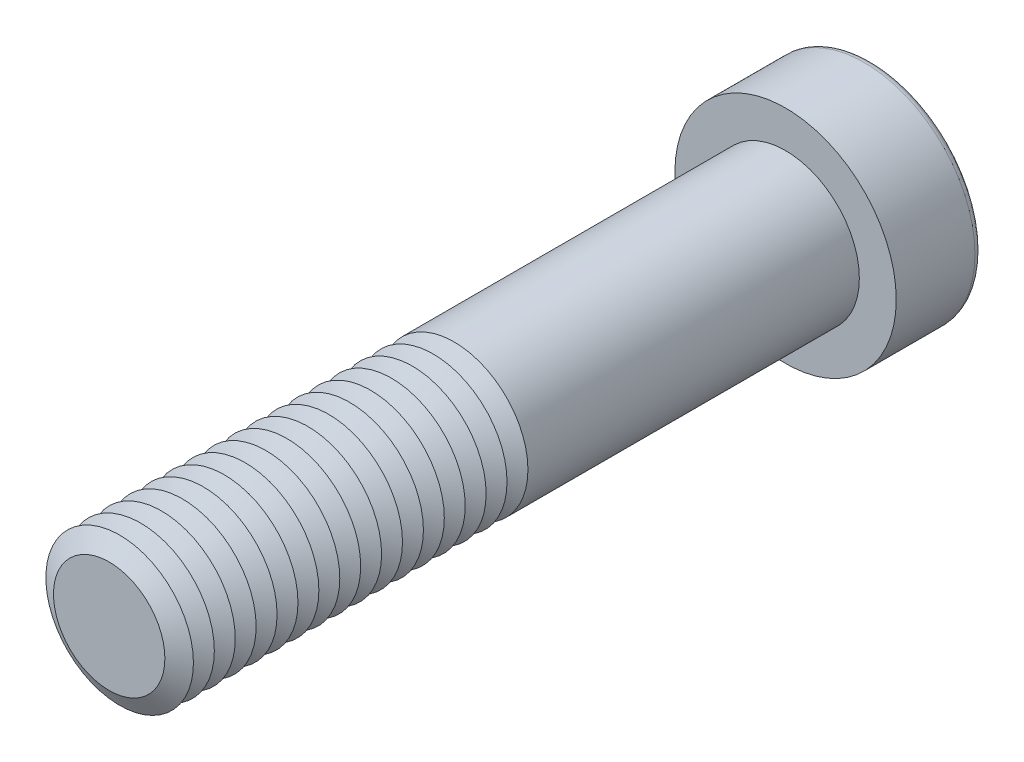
SolidWorks part; units mm, degrees
ref_plane "Front Plane" through (0, 0, 0) normal (0, 0, 1) x (1, 0, 0)
ref_plane "Top Plane" through (0, 0, 0) normal (0, 1, 0) x (1, 0, 0)
ref_plane "Right Plane" through (0, 0, 0) normal (1, 0, 0) x (0, 0, -1)
sketch "Sketch1" plane through (0, 0, 0) normal (0, 0, 1) x (1, 0, 0)
  circle A0 centre (0, 0) radius 6
  dimension "D1" = 12
extrude "Boss-Extrude1" add sketch "Sketch1" along normal blind 55
sketch "Sketch2" plane through (0, 0, 0) normal (0, 0, -1) x (-1, 0, 0)
  circle A0 centre (0, 0) radius 9
  dimension "D1" = 18
extrude "Boss-Extrude2" add sketch "Sketch2" along normal blind 7
sketch "Sketch3" plane through (0, 0, -7) normal (0, 0, -1) x (-1, 0, 0)
  line L1 (-2.3094, 4) -> (-4.6188, 0)
  line L2 (-4.6188, 0) -> (-2.3094, -4)
  line L3 (-2.3094, -4) -> (2.3094, -4)
  line L4 (2.3094, -4) -> (4.6188, 0)
  line L5 (4.6188, 0) -> (2.3094, 4)
  line L6 (2.3094, 4) -> (-2.3094, 4)
  circle A0 centre (0, 0) radius 4 construction
  dimension "D1" = 8
extrude "Cut-Extrude1" cut sketch "Sketch3" against normal blind 6
fillet "Fillet1" radius 0.6 1 edges at (-9, 0, -7)
sketch "Sketch4" plane through (0, 0, -1) normal (0, 0, -1) x (-1, 0, 0)
  line L0 (2.3094, -4) -> (4.6188, 0) construction
  circle A0 centre (0, 0) radius 4
extrude "Cut-Extrude2" cut sketch "Sketch4" against normal through all draft 60
sketch "Sketch5" plane through (0, 0, -7) normal (0, 0, -1) x (-1, 0, 0)
  circle A0 centre (0, 0) radius 4.6188
extrude "Cut-Extrude3" cut sketch "Sketch5" against normal through all draft 75
sketch "Sketch7" plane through (0, 0, 0) normal (1, 0, 0) x (0, 0, -1)
  line L25 (-55, 4.5278) -> (-54.15, 6)
  line L26 (-55, 6) -> (-55, -6) construction
  line L27 (-54.15, 6) -> (-55.85, 6)
  line L28 (-55.85, 6) -> (-55, 4.5278)
  line L29 (0, 6) -> (-55, 6) construction
  dimension "D1" = 1.7
revolve "Cut-Revolve1" cut sketch "Sketch7" angle 360 about axis through (0, 0, 55) along (0, 0, -1)
pattern_linear "LPattern1" count 17 spacing 1.7 along (0, 0, -1) of "Cut-Revolve1"
